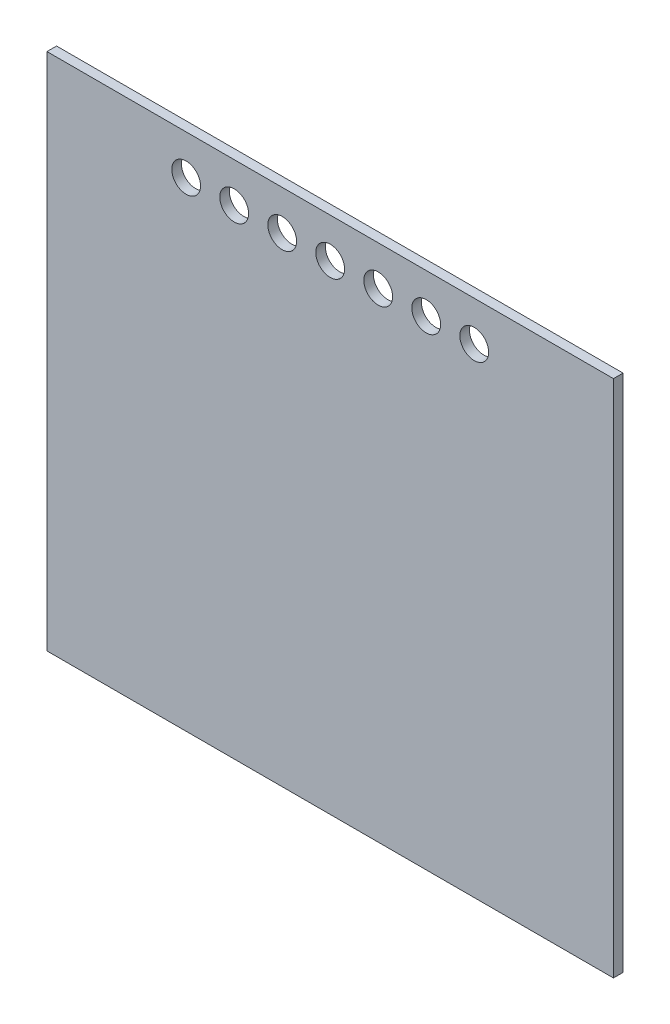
SolidWorks part; units mm, degrees
ref_plane "Front Plane" through (0, 0, 0) normal (0, 0, 1) x (1, 0, 0)
ref_plane "Top Plane" through (0, 0, 0) normal (0, 1, 0) x (1, 0, 0)
ref_plane "Right Plane" through (0, 0, 0) normal (1, 0, 0) x (0, 0, -1)
sketch "Sketch1" plane through (0, 0, 0) normal (0, 0, 1) x (1, 0, 0)
  line L1 (-374.65, 343.2937) -> (374.65, 343.2937)
  line L2 (-374.65, 343.2937) -> (-374.65, -343.2937)
  line L3 (-374.65, -343.2937) -> (374.65, -343.2937)
  line L4 (374.65, 343.2937) -> (374.65, -343.2937)
  line L5 (-374.65, 343.2937) -> (374.65, -343.2937) construction
  line L6 (-374.65, -343.2937) -> (374.65, 343.2937) construction
  point P0 (0, 0)
  dimension "D1" = 749.3
  dimension "D2" = 686.5874
extrude "Boss-Extrude1" add sketch "Sketch1" against normal blind 12.7
sketch "Sketch2" plane through (0, 0, 0) normal (0, 0, 1) x (1, 0, 0)
  line L0 (-190.5, 290.9062) -> (190.5, 290.9062) construction
  line L1 (0, 0) -> (0, 598.5143) construction
  line L2 (374.65, 343.2937) -> (-374.65, 343.2937) construction
  circle A0 centre (-190.5, 290.9062) radius 19.05
  circle A1 centre (190.5, 290.9062) radius 19.05
  circle A2 centre (-127, 290.9062) radius 19.05
  circle A3 centre (-63.5, 290.9062) radius 19.05
  circle A4 centre (0, 290.9062) radius 19.05
  circle A5 centre (63.5, 290.9062) radius 19.05
  circle A6 centre (127, 290.9062) radius 19.05
  dimension "D1" = 38.1
  dimension "D3" = 63.5
  dimension "D4" = 63.5
  dimension "D5" = 52.3875
  dimension "D6" = 63.5
  dimension "D7" = 63.5
  dimension "D2" = 381
extrude "Cut-Extrude1" cut sketch "Sketch2" against normal through all
